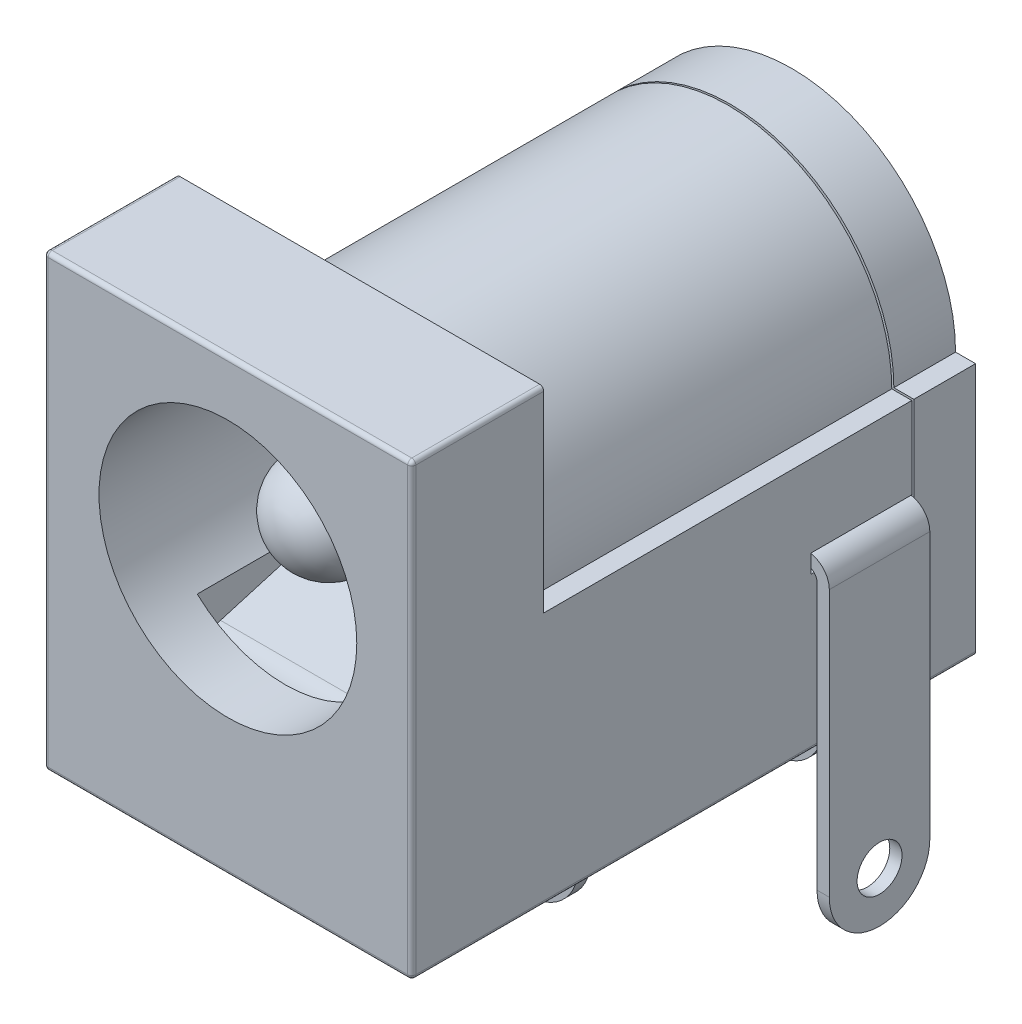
SolidWorks part; units mm, degrees
ref_plane "Plano frontal" through (0, 0, 0) normal (0, 0, 1) x (1, 0, 0)
ref_plane "Plano superior" through (0, 0, 0) normal (0, 1, 0) x (1, 0, 0)
ref_plane "Plano direito" through (0, 0, 0) normal (1, 0, 0) x (0, 0, -1)
sketch "Esboço1" plane through (0, 0, 0) normal (0, 0, 1) x (1, 0, 0)
  line L1 (-4.5, 4.5) -> (4.5, 4.5)
  line L2 (-4.5, 4.5) -> (-4.5, -6.5)
  line L3 (-4.5, -6.5) -> (4.5, -6.5)
  line L4 (4.5, 4.5) -> (4.5, -6.5)
  line L5 (-4.5, 4.5) -> (4.5, -6.5) construction
  line L6 (-4.5, -6.5) -> (4.5, 4.5) construction
  circle A0 centre (0, 0) radius 3.155 construction
  point P0 (0, -1)
  dimension "D3" = 6.31
  dimension "D1" = 11
  dimension "D2" = 9
  dimension "D4" = 6.5
extrude "Ressalto-extrusão1" add sketch "Esboço1" along normal mid plane 12.24
sketch "Esboço2" plane through (0, 0, -6.12) normal (0, 0, -1) x (-1, 0, 0)
  line L0 (-4.5, -0.3) -> (-4.01, -0.3)
  line L1 (-4.5, -6.5) -> (-4.5, 4.5) construction
  line L2 (4.5, -6.5) -> (-4.5, -6.5) construction
  line L3 (4.01, -0.3) -> (4.5, -0.3)
  line L4 (4.5, 4.5) -> (4.5, -6.5) construction
  line L9 (-4.5, 4.5) -> (-4.5, -6.5)
  line L10 (-4.5, -6.5) -> (4.5, -6.5)
  line L11 (4.5, -6.5) -> (4.5, 4.5)
  line L12 (4.5, 4.5) -> (-4.5, 4.5)
  line L13 (-4.5, 4.5) -> (-4.5, -0.3)
  line L15 (4.5, -0.3) -> (4.5, 4.5)
  line L16 (4.5, 4.5) -> (-4.5, 4.5)
  arc A0 (-4.01, -0.3) -> (4.01, -0.3) centre (0, -0.3) cw
  point P15 (0, 3.71)
  dimension "D3" = 10.21
  dimension "D1" = 6.2
  dimension "D4" = 8.02
  dimension "D2" = 0
extrude "Corte-extrusão1" cut sketch "Esboço2" against normal offset from surface (9.01 mm away) 3.23
sketch "Esboço3" plane through (0, 0, -6.12) normal (0, 0, -1) x (-1, 0, 0)
  line L10 (-3.4742, -0.8) -> (-4, -0.8)
  line L11 (-4, -0.8) -> (-4, -6)
  line L12 (-4, -6) -> (4, -6)
  line L13 (4, -6) -> (4, -0.8)
  line L14 (4, -0.8) -> (3.4742, -0.8)
  line L15 (-3.4742, -0.8) -> (-4, -0.8)
  line L16 (-4, -0.8) -> (-4, -6)
  line L17 (-4, -6) -> (4, -6)
  line L18 (4, -6) -> (4, -0.8)
  line L19 (4, -0.8) -> (3.4742, -0.8)
  arc A2 (3.4742, -0.8) -> (-3.4742, -0.8) centre (0, -0.3) ccw
  arc A3 (3.4742, -0.8) -> (-3.4742, -0.8) centre (0, -0.3) ccw
  dimension "D1" = 0.5
extrude "Ressalto-extrusão2" add sketch "Esboço3" along normal blind 0.05
sketch "Esboço4" plane through (0, 0, -6.17) normal (0, 0, -1) x (-1, 0, 0)
  line L5 (-4.01, -0.3) -> (-4.5, -0.3)
  line L6 (-4.5, -0.3) -> (-4.5, -6.5)
  line L7 (-4.5, -6.5) -> (4.5, -6.5)
  line L8 (4.5, -6.5) -> (4.5, -0.3)
  line L9 (4.5, -0.3) -> (4.01, -0.3)
  line L10 (-4.01, -0.3) -> (-4.5, -0.3)
  line L11 (-4.5, -0.3) -> (-4.5, -6.5)
  line L12 (-4.5, -6.5) -> (4.5, -6.5)
  line L13 (4.5, -6.5) -> (4.5, -0.3)
  line L14 (4.5, -0.3) -> (4.01, -0.3)
  arc A1 (4.01, -0.3) -> (-4.01, -0.3) centre (0, -0.3) ccw
  arc A2 (4.01, -0.3) -> (-4.01, -0.3) centre (0, -0.3) ccw
  dimension "D1" = 0
extrude "Ressalto-extrusão3" add sketch "Esboço4" along normal offset from surface (1.51 mm away) 13.8
sketch "Esboço5" plane through (0, 0, -7.68) normal (0, 0, -1) x (-1, 0, 0)
  line L0 (0.8924, 1.84) -> (-0.8924, 1.84)
  line L1 (4.5, -6.5) -> (-4.5, -6.5) construction
  line L2 (1.28, -6.5) -> (-1.28, -6.5)
  line L3 (1.28, -6.5) -> (1.28, -1.5949)
  line L5 (-1.28, -6.5) -> (-1.28, -1.5949)
  arc A0 (-0.8924, 1.84) -> (-1.28, -1.5949) centre (0, 0) ccw
  arc A1 (1.28, -1.5949) -> (0.8924, 1.84) centre (0, 0) ccw
  dimension "D1" = 4.09
  dimension "D2" = 1.84
  dimension "D3" = 2.56
extrude "Corte-extrusão2" cut sketch "Esboço5" against normal offset from surface (0.45 mm away) 13.35
sketch "Esboço6" plane through (0, 0, -7.23) normal (0, 0, -1) x (-1, 0, 0)
  line L5 (4.5, -6.5) -> (-4.5, -6.5) construction
  line L8 (1.23, -6.45) -> (1.23, -1.5707)
  line L9 (0.8809, 1.79) -> (-0.8809, 1.79)
  line L10 (-1.23, -1.5707) -> (-1.23, -6.45)
  line L11 (-1.23, -6.45) -> (1.23, -6.45)
  line L12 (1.23, -9.37) -> (1.23, -1.5707)
  line L13 (0.8809, 1.79) -> (-0.8809, 1.79)
  line L14 (-1.23, -1.5707) -> (-1.23, -9.37)
  arc A2 (-1.23, -9.37) -> (1.23, -9.37) centre (0, -9.37) ccw
  arc A4 (1.23, -1.5707) -> (0.8809, 1.79) centre (0, 0) ccw
  arc A5 (-0.8809, 1.79) -> (-1.23, -1.5707) centre (0, 0) ccw
  arc A6 (1.23, -1.5707) -> (0.8809, 1.79) centre (0, 0) ccw
  arc A7 (-0.8809, 1.79) -> (-1.23, -1.5707) centre (0, 0) ccw
  dimension "D2" = 2.46
  dimension "D3" = 4.1
  dimension "D1" = 0.05
extrude "Ressalto-extrusão4" add sketch "Esboço6" along normal blind 0.3
sketch "Esboço8" plane through (0, 0, 6.12) normal (0, 0, 1) x (1, 0, 0)
  circle A0 centre (0, 0) radius 3.155 construction
  circle A1 centre (0, 0) radius 3.155
extrude "Corte-extrusão3" cut sketch "Esboço8" against normal up to surface (12.24 mm away)
sketch "Esboço9" plane through (0, 0, -6.12) normal (0, 0, 1) x (1, 0, 0)
  circle A0 centre (0, 0) radius 1.45
  dimension "D1" = 2.9
extrude "Ressalto-extrusão6" add sketch "Esboço9" along normal offset from surface (0.1 mm away) 0.1
sketch "Esboço10" plane through (0, 0, -6.12) normal (0, 0, 1) x (1, 0, 0)
  circle A0 centre (0, 0) radius 1.25
extrude "Ressalto-extrusão7" add sketch "Esboço10" along normal offset from surface (11.02 mm away) 1.22
fillet "Filete1" radius 1.25 1 edges at (1.25, 0, 4.9)
ref_plane "Plano1" through (0, 0, -1.23) normal (0, 0, 1) x (1, 0, 0)
sketch "Esboço11" plane through (0, 0, -1.23) normal (0, 0, 1) x (1, 0, 0)
  line L0 (1.23, -6.5) -> (-1.23, -6.5) construction
  line L3 (1.23, -9.37) -> (1.23, -6.5)
  line L4 (1.23, -6.5) -> (-1.23, -6.5)
  line L5 (-1.23, -6.5) -> (-1.23, -9.37)
  line L6 (1.23, -9.37) -> (1.23, -5.5)
  line L7 (1.23, -5.5) -> (-1.23, -5.5)
  line L8 (-1.23, -5.5) -> (-1.23, -9.37)
  arc A1 (-1.23, -9.37) -> (1.23, -9.37) centre (0, -9.37) ccw
  arc A2 (-1.23, -9.37) -> (1.23, -9.37) centre (0, -9.37) ccw
  dimension "D2" = 1
  dimension "D1" = 0
extrude "Ressalto-extrusão8" add sketch "Esboço11" against normal blind 0.3
sketch "Esboço12" plane through (0, -6.5, 0) normal (0, -1, 0) x (1, 0, 0)
  line L0 (1.23, -1.23) -> (-1.23, -1.23) construction
  line L1 (-1.28, -1.23) -> (-1.23, -1.23)
  line L2 (-1.28, -1.23) -> (-1.28, -6.17)
  line L3 (-1.28, -6.17) -> (1.28, -6.17)
  line L4 (1.28, -1.23) -> (1.28, -6.17)
  line L5 (4.5, -6.17) -> (-4.5, -6.17) construction
  line L6 (-4.5, -6.12) -> (4.5, -6.12) construction
  line L7 (-1.23, -1.53) -> (-1.23, -1.23) construction
  line L8 (1.23, -1.23) -> (1.23, -1.53) construction
  line L9 (1.23, -1.23) -> (1.28, -1.23)
  line L13 (1.23, -1.23) -> (-1.23, -1.23)
  line L14 (-1.23, -1.23) -> (-1.23, -1.53)
  line L15 (-1.23, -1.53) -> (1.23, -1.53)
  line L16 (1.23, -1.53) -> (1.23, -1.23)
  line L18 (-1.23, -1.23) -> (-1.23, -1.53)
  line L19 (-1.23, -1.53) -> (1.23, -1.53)
  line L20 (1.23, -1.53) -> (1.23, -1.23)
  point P12 (-1.23, -1.38)
  point P15 (1.23, -1.38)
extrude "Corte-extrusão4" cut sketch "Esboço12" against normal up to surface (0.5 mm away)
sketch "Esboço13" plane through (0, -6, 0) normal (0, -1, 0) x (1, 0, 0)
  line L0 (4.5, -6.17) -> (-4.5, -6.17) construction
  line L1 (-1.23, -1.53) -> (1.23, -1.53)
  line L2 (-1.23, -1.53) -> (-1.23, -6.17)
  line L3 (-1.23, -6.17) -> (1.23, -6.17)
  line L4 (1.23, -1.53) -> (1.23, -6.17)
extrude "Ressalto-extrusão9" add sketch "Esboço13" along normal up to surface (0.5 mm away)
hole_wizard "Furo1" positions "Esboço14" profile "Esboço15" legacy
sketch "Esboço14" plane through (0, 0, -7.53) normal (0, 0, -1) x (-1, 0, 0)
  point P0 (0, -9.37)
sketch "Esboço15" plane through (0, -9.37, -7.53) normal (1, 0, 0) x (0, 1, 0)
  line L0 (0, 0) -> (0, 13.65)
  line L1 (0, 13.65) -> (0.55, 13.65)
  line L2 (0.55, 13.65) -> (0.55, 0)
  line L3 (0.55, 0) -> (0, 0)
  line L4 (0, 110) -> (0, -10) construction
  dimension "Diameter" = 1.1
  dimension "Depth" = 13.65
sketch "Esboço16" plane through (0, 0, 0) normal (1, 0, 0) x (0, 0, -1)
  line L1 (-4.72, -3.155) -> (1.53, -3.155) construction
  line L2 (-4.72, -3.155) -> (-4.72, -4.155)
  line L3 (-4.72, -4.155) -> (1.53, -4.155)
  line L4 (1.53, -3.155) -> (1.53, -4.155)
  line L6 (-6.12, -6.5) -> (-6.12, 4.5) construction
  line L7 (1.53, -9.37) -> (1.53, -6.5) construction
  line L8 (-4.72, -3.155) -> (-4.72, -2.155)
  line L9 (-4.72, -2.155) -> (1.53, -2.155)
  line L10 (1.53, -2.155) -> (1.53, -3.155)
  point P4 (-6.12, -3.155)
  dimension "D1" = 1.4
  dimension "D2" = 1
  dimension "D3" = 1
extrude "Corte-extrusão6" cut sketch "Esboço16" against normal mid plane 4.3
sketch "Esboço17" plane through (0, 0, 0) normal (1, 0, 0) x (0, 0, -1)
  line L0 (1.23, -9.37) -> (1.23, -6.5) construction
  line L1 (1.23, -6.5) -> (1.53, -6.5)
  line L2 (1.23, -6.5) -> (1.23, -4.2678)
  line L3 (1.3459, -2.5983) -> (5.02, -2.5983)
  line L4 (1.53, -6.5) -> (1.53, -4.2678)
  line L5 (1.53, -9.37) -> (1.53, -6.5) construction
  line L6 (-6.12, -6.5) -> (6.12, -6.5) construction
  line L7 (-4.2511, -3.05) -> (0.3878, -1.6939)
  line L8 (1.0172, -3.755) -> (-4.1072, -3.755)
  line L9 (6.02, -1.25) -> (-3.65, -1.25)
  line L10 (1.0172, -4.055) -> (-4.1072, -4.055)
  line L11 (-3.5, 1.175) -> (5.795, 1.175)
  line L12 (1.0239, -2.0422) -> (1.1417, -2.4452)
  line L14 (0.8537, -2.5294) -> (0.7359, -2.1264)
  line L15 (0.472, -1.9818) -> (-4.1669, -3.3379)
  line L16 (5.02, -2.5983) -> (5.02, -2.8983)
  line L17 (6.02, -1.25) -> (-3.65, -1.25) construction
  line L18 (-1.545, -4.055) -> (-1.545, -3.755) construction
  line L19 (-4.2511, -3.05) -> (-4.1669, -3.3379) construction
  line L20 (-4.72, -3.155) -> (-4.72, -4.155) construction
  line L21 (5.02, -2.8983) -> (1.3459, -2.8983)
  line L22 (-6.12, 3.155) -> (-6.12, -3.155) construction
  line L23 (-4.72, -4.155) -> (1.53, -4.155) construction
  arc A0 (-4.1072, -4.055) -> (-4.2511, -3.05) centre (-4.1072, -3.5422) cw
  arc A1 (1.0172, -3.755) -> (1.53, -4.2678) centre (1.0172, -4.2678) cw
  arc A2 (0.3878, -1.6939) -> (1.0239, -2.0422) centre (0.5317, -2.1861) cw
  arc A3 (0.7359, -2.1264) -> (0.472, -1.9818) centre (0.5317, -2.1861) ccw
  arc A4 (1.23, -4.2678) -> (1.0172, -4.055) centre (1.0172, -4.2678) ccw
  arc A5 (-4.1669, -3.3379) -> (-4.1072, -3.755) centre (-4.1072, -3.5422) ccw
  arc A6 (1.1417, -2.4452) -> (1.3459, -2.5983) centre (1.3459, -2.3855) ccw
  arc A7 (1.3459, -2.8983) -> (0.8537, -2.5294) centre (1.3459, -2.3855) cw
  point P39 (1.53, -3.755)
  point P42 (0.88, -1.55)
  dimension "D1" = 0.1
  dimension "D5" = 0.925
  dimension "D7" = 0.2128
  dimension "D8" = 0.5128
  dimension "D2" = 0.3
  dimension "D3" = 7
  dimension "D4" = 0.1
  dimension "D6" = 1.8
  dimension "D9" = 0.3
  dimension "D10" = 1
extrude "Ressalto-extrusão10" add sketch "Esboço17" against normal offset from surface 0.1 and the other way offset from surface (2.05 mm away) 0.1
hole_wizard "Furo2" positions "Esboço18" profile "Esboço19" legacy
sketch "Esboço18" plane through (0, 0, -7.53) normal (0, 0, -1) x (-1, 0, 0)
  point P0 (0, 0)
sketch "Esboço19" plane through (0, 0, -7.53) normal (1, 0, 0) x (0, 1, 0)
  line L0 (0, 0) -> (0, 1.3906)
  line L1 (0, 1.3906) -> (0.65, 1)
  line L2 (0.65, 1) -> (0.65, 0)
  line L4 (0.65, 0) -> (0, 0)
  line L6 (0, 1.3906) -> (-0.65, 1) construction
  line L7 (0, -4.2442) -> (0, 117.3081) construction
  dimension "Diameter" = 1.3
  dimension "Depth" = 1
  dimension "Drill Angle" = 118
sketch "Esboço20" plane through (0, 0, 0) normal (1, 0, 0) x (0, 0, -1)
  line L0 (7.53, 0) -> (7.8028, 0) construction
  line L1 (7.53, 0.65) -> (7.8158, 1.145)
  line L2 (7.8158, 1.145) -> (7.5993, 1.27)
  line L3 (7.53, 0.65) -> (7.8028, 0.65) construction
  line L4 (7.5993, 1.27) -> (7.53, 1.15)
  line L5 (7.53, 1.15) -> (7.53, 0.65)
  point P5 (7.53, 0.65)
  dimension "D1" = 2.54
  dimension "D2" = 120
  dimension "D3" = 0.25
revolve "Revolução1" add sketch "Esboço20" angle 360 about L0
sketch "Esboço21" plane through (4.5, 0, 0) normal (1, 0, 0) x (0, 0, -1)
  line L0 (6.17, -0.8) -> (6.17, -6) construction
  line L1 (6.17, -2.3) -> (3.65, -2.3)
  line L2 (6.17, -2.3) -> (6.17, -2.75)
  line L3 (6.17, -2.75) -> (3.65, -2.75)
  line L4 (3.65, -2.3) -> (3.65, -2.75)
  line L6 (6.12, -6.5) -> (6.12, -0.3) construction
  line L7 (-6.12, -6.5) -> (6.12, -6.5) construction
  dimension "D1" = 2.47
  dimension "D2" = 0.45
  dimension "D3" = 4.2
fillet "Filete2" radius 0.3 1 edges at (0.65, 0, -7.53)
fillet "Filete3" radius 0.1 10 edges at (-4.5, -6.5, 0) (-4.5, -6.5, -6.925) (4.5, -6.5, -6.925) (4.5, -6.5, 0) (-4.5, 4.5, 4.505) (4.5, 4.5, 4.505) (4.5, -1, 6.12) (0, 4.5, 6.12) (-4.5, -1, 6.12) (0, -6.5, 6.12)
extrude "Corte-extrusão7" cut sketch "Esboço21" against normal up to surface (0.5 mm away)
sketch "Esboço22" plane through (0, 0, -3.65) normal (0, 0, -1) x (-1, 0, 0)
  line L0 (-4.65, -2.85) -> (-4.65, -10.6)
  line L1 (-4.65, -10.6) -> (-4.95, -10.6)
  line L2 (-4.95, -10.6) -> (-4.95, -2.85)
  line L3 (-4.65, -10.6) -> (0, -10.6) construction
  line L4 (-4, -2.3) -> (-4.5, -2.3)
  line L5 (-4.5, -2.3) -> (-4.5, -2.75)
  line L6 (-4.5, -2.75) -> (-4, -2.75)
  line L7 (-4, -2.75) -> (-4, -2.3)
  line L8 (2.05, -2.3) -> (-4.4, -2.3)
  line L10 (-4.4, -2.6) -> (2.05, -2.6)
  line L11 (2.05, -2.6) -> (2.05, -2.3)
  line L12 (4.5, -0.3) -> (4.5, -6.4) construction
  line L13 (2.05, -1.6939) -> (2.05, -3.05) construction
  arc A0 (-4.4, -2.6) -> (-4.65, -2.85) centre (-4.4, -2.85) ccw
  arc A1 (-4.95, -2.85) -> (-4.4, -2.3) centre (-4.4, -2.85) cw
  arc A2 (-1.23, -9.37) -> (1.23, -9.37) centre (0, -9.37) ccw construction
  dimension "D2" = 0.25
  dimension "D4" = 0.55
  dimension "D3" = 0.3
  dimension "D5" = 9.45
  dimension "D1" = 0
extrude "Ressalto-extrusão11" add sketch "Esboço22" along normal blind 2.46
sketch "Esboço23" plane through (4.95, 0, 0) normal (1, 0, 0) x (0, 0, -1)
  line L0 (3.65, -2.85) -> (3.65, -10.6) construction
  line L1 (6.11, -10.6) -> (6.11, -2.85) construction
  line L2 (6.11, -10.6) -> (3.65, -10.6) construction
  line L7 (3.65, -10.6) -> (6.11, -10.6)
  line L8 (6.11, -10.6) -> (6.11, -2.85)
  line L9 (6.11, -2.85) -> (3.65, -2.85)
  line L10 (3.65, -2.85) -> (3.65, -10.6)
  line L11 (3.65, -10.6) -> (6.11, -10.6)
  line L12 (6.11, -10.6) -> (6.11, -9.37)
  line L14 (3.65, -9.37) -> (3.65, -10.6)
  arc A0 (3.65, -9.37) -> (6.11, -9.37) centre (4.88, -9.37) ccw
  dimension "D1" = 0
extrude "Corte-extrusão8" cut sketch "Esboço23" against normal through all contours A0 M8 M5 | A0 L11 M6
hole_wizard "Furo3" positions "Esboço24" profile "Esboço25" legacy
sketch "Esboço24" plane through (4.95, 0, 0) normal (1, 0, 0) x (0, 0, -1)
  point P0 (4.88, -9.37)
sketch "Esboço25" plane through (4.95, -9.37, -4.88) normal (0, 1, 0) x (0, 0, -1)
  line L0 (0, 0) -> (0, 9.45)
  line L1 (0, 9.45) -> (0.55, 9.45)
  line L2 (0.55, 9.45) -> (0.55, 0)
  line L3 (0.55, 0) -> (0, 0)
  line L4 (0, 110) -> (0, -10) construction
  dimension "Diameter" = 1.1
  dimension "Depth" = 9.45
equation "\"D1@Filete1\"=\"D1@Esboço10\"/2"
equation "\"D2@Esboço12\"=\"D1@Esboço12\""
equation "\"D3@Esboço12\"=\"D2@Esboço12\""
